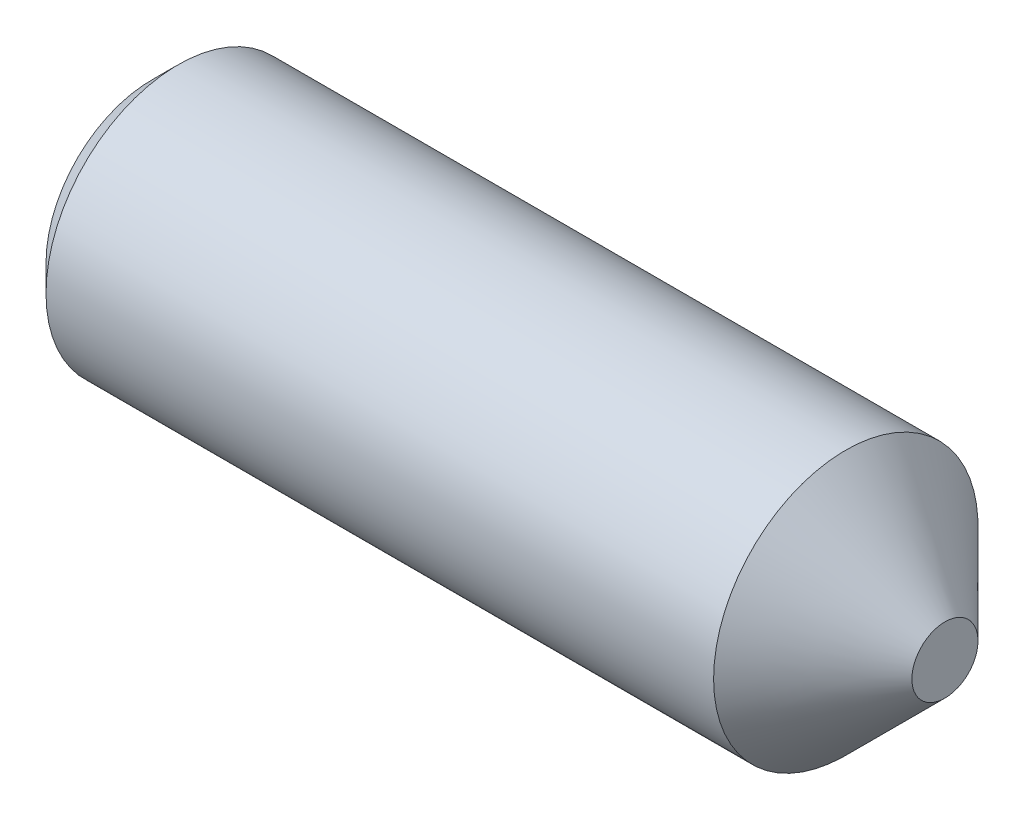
SolidWorks part; units mm, degrees
ref_plane "Plan1" through (0, 0, 0) normal (0, 0, 1) x (1, 0, 0)
ref_plane "Plan2" through (0, 0, 0) normal (0, 1, 0) x (1, 0, 0)
ref_plane "Plan3" through (0, 0, 0) normal (1, 0, 0) x (0, 0, -1)
sketch "Esquisse2" plane through (0, 0, 0) normal (0, 0, 1) x (1, 0, 0)
  line L0 (-21.25, 0) -> (30, 0) construction
  line L1 (-20.25, 5) -> (5, 5)
  line L2 (-21.25, 0) -> (8.75, 0)
  line L3 (-21.25, 4) -> (-21.25, 0)
  line L4 (5, 5) -> (8.75, 1.25)
  line L5 (8.75, 1.25) -> (8.75, 0)
  line L6 (-21.25, 4) -> (-20.25, 5)
  point P3 (-21.25, 5)
  dimension "D1" = 5
  dimension "D2" = 30
  dimension "D3" = 45
  dimension "D4" = 2.5
  dimension "D7" = 1
revolve "Base-Révolution" add sketch "Esquisse2" angle 360 about L0
sketch "Esquisse3" plane through (-21.25, 0, 0) normal (-1, 0, 0) x (0, 0, 1)
  line L1 (2.8868, 0) -> (1.4434, 2.5)
  line L2 (1.4434, 2.5) -> (-1.4434, 2.5)
  line L3 (-1.4434, 2.5) -> (-2.8868, 0)
  line L4 (-2.8868, 0) -> (-1.4434, -2.5)
  line L5 (-1.4434, -2.5) -> (1.4434, -2.5)
  line L6 (1.4434, -2.5) -> (2.8868, 0)
  circle A0 centre (0, 0) radius 2.5 construction
  dimension "D1" = 5
extrude "Enlèv. mat.-Extru.1" cut sketch "Esquisse3" against normal blind 5
